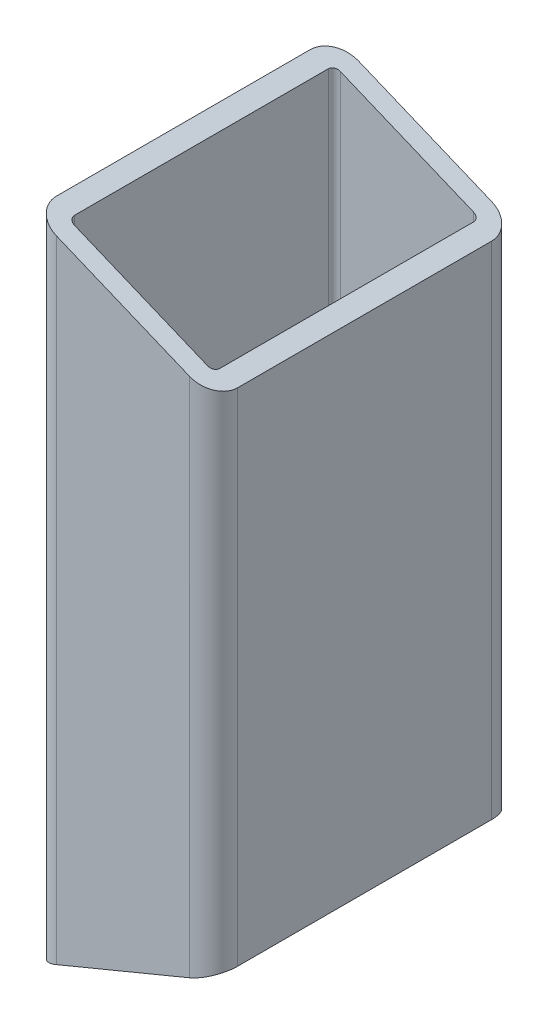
SolidWorks part; units mm, degrees
ref_plane "Plan de face" through (0, 0, 0) normal (0, 0, 1) x (1, 0, 0)
ref_plane "Plan de dessus" through (0, 0, 0) normal (0, 1, 0) x (1, 0, 0)
ref_plane "Plan de droite" through (0, 0, 0) normal (1, 0, 0) x (0, 0, -1)
ref_plane "Plan1" through (0, 0, 25) normal (0, 0, 1) x (1, 0, 0)
sketch "Esquisse1" plane through (0, 0, 25) normal (0, 0, 1) x (1, 0, 0)
  line L0 (-15, -53.85) -> (15, -41.4236)
  line L1 (15, -41.4236) -> (15, 41.4236)
  line L2 (15, 41.4236) -> (-15, 53.85)
  line L3 (-15, 53.85) -> (-15, -53.85)
extrude "Boss.-Extru.1" add sketch "Esquisse1" against normal blind 3
sketch "Esquisse2" plane through (0, 0, 22) normal (0, 0, -1) x (-1, 0, 0)
  line L0 (-15, 41.4236) -> (-12, 42.6662)
  line L1 (-12, 42.6662) -> (-12, -42.6662)
  line L2 (-12, -42.6662) -> (-15, -41.4236)
  line L3 (-15, -41.4236) -> (-15, 41.4236)
extrude "Boss.-Extru.2" add sketch "Esquisse2" along normal blind 44
sketch "Esquisse3" plane through (0, 0, 22) normal (0, 0, -1) x (-1, 0, 0)
  line L0 (15, -53.85) -> (12, -52.6074)
  line L1 (12, -52.6074) -> (12, 52.6074)
  line L2 (12, 52.6074) -> (15, 53.85)
  line L3 (15, 53.85) -> (15, -53.85)
extrude "Boss.-Extru.3" add sketch "Esquisse3" along normal blind 44
sketch "Esquisse4" plane through (0, 0, -22) normal (0, 0, -1) x (-1, 0, 0)
  line L0 (15, -53.85) -> (-15, -41.4236)
  line L1 (-15, -41.4236) -> (-15, 41.4236)
  line L2 (-15, 41.4236) -> (15, 53.85)
  line L3 (15, 53.85) -> (15, -53.85)
extrude "Boss.-Extru.4" add sketch "Esquisse4" along normal blind 3
fillet "Congé1" radius 1 4 edges at (12, 0, -22) (-12, 0, -22) (-12, 0, 22)
fillet "Congé2" radius 4 4 edges at (15, 0, 25) (-15, 0, 25) (15, 0, -25) (-15, 0, -25)
